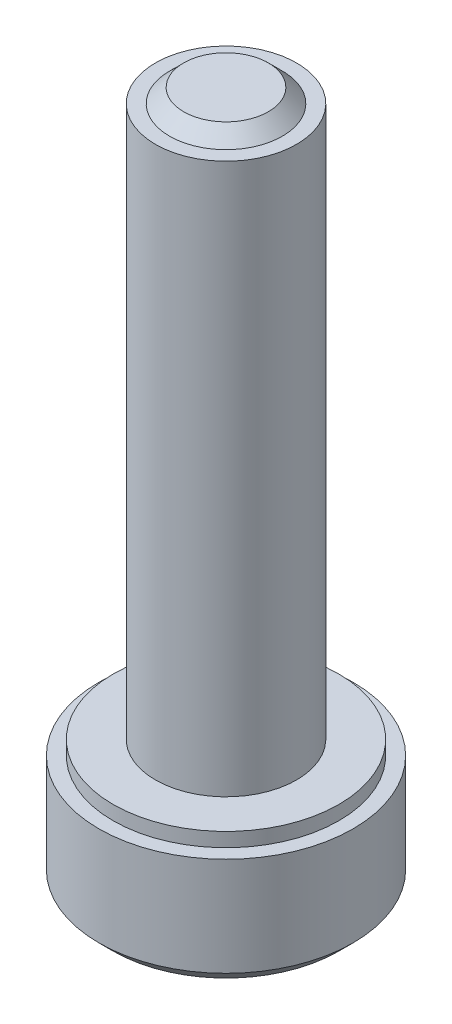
SolidWorks part; units mm, degrees
ref_plane "Front Plane" through (0, 0, 0) normal (0, 0, 1) x (1, 0, 0)
ref_plane "Top Plane" through (0, 0, 0) normal (0, 1, 0) x (1, 0, 0)
ref_plane "Right Plane" through (0, 0, 0) normal (1, 0, 0) x (0, 0, -1)
sketch "Sketch2" plane through (0, 0, 0) normal (0, 1, 0) x (1, 0, 0)
  circle A0 centre (0, 0) radius 9
  dimension "D1" = 18
extrude "Boss-Extrude1" add sketch "Sketch2" along normal blind 8
sketch "Sketch3" plane through (0, 8, 0) normal (0, 1, 0) x (1, 0, 0)
  circle A0 centre (0, 0) radius 8
  dimension "D1" = 16
extrude "Boss-Extrude2" add sketch "Sketch3" along normal blind 1
sketch "Sketch4" plane through (0, 9, 0) normal (0, 1, 0) x (1, 0, 0)
  circle A0 centre (0, 0) radius 5
  dimension "D1" = 10
extrude "Boss-Extrude3" add sketch "Sketch4" along normal blind 39
sketch "Sketch5" plane through (0, 48, 0) normal (0, 1, 0) x (1, 0, 0)
  circle A0 centre (0, 0) radius 4
  dimension "D1" = 8
extrude "Boss-Extrude4" add sketch "Sketch5" along normal blind 1
chamfer "Chamfer1" distance 1 angle 45 1 edges at (0, 49, 4)
chamfer "Chamfer2" distance 1 angle 45 1 edges at (0, 0, 9)
